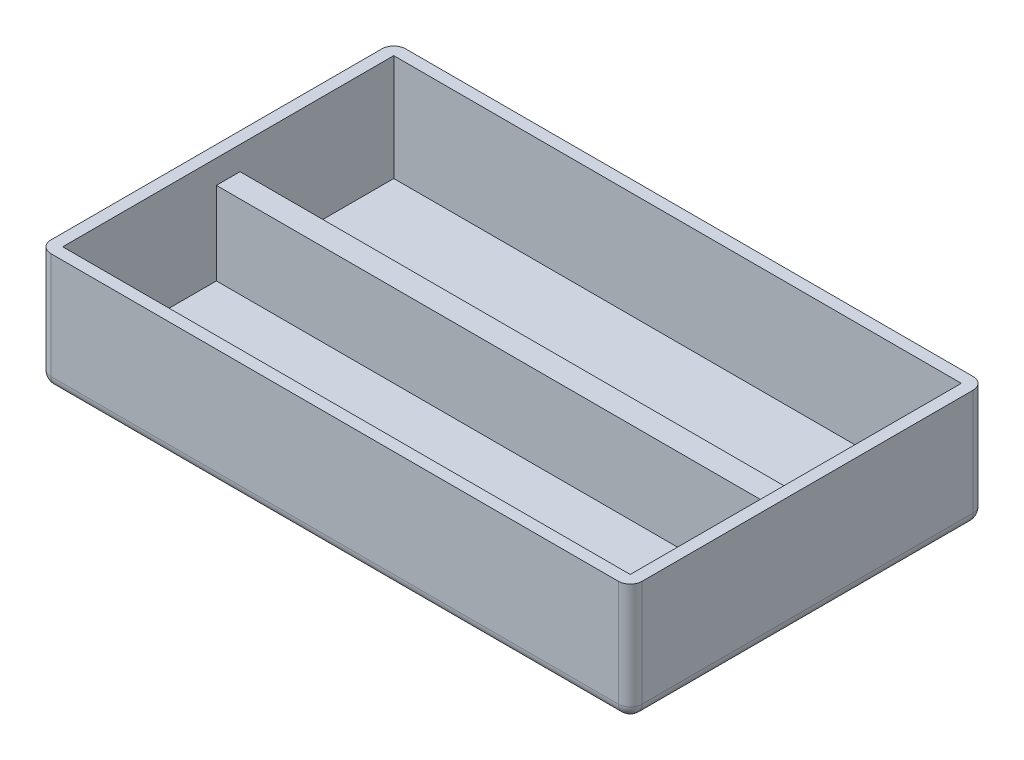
SolidWorks part; units mm, degrees
ref_plane "Front" through (0, 0, 0) normal (0, 0, 1) x (1, 0, 0)
ref_plane "Top" through (0, 0, 0) normal (0, 1, 0) x (1, 0, 0)
ref_plane "Right" through (0, 0, 0) normal (1, 0, 0) x (0, 0, -1)
sketch "Sketch1"
  dimension "D1" = 127
  dimension "D2" = 76.2
extrude "Extrude1" add sketch "Sketch1" along normal blind 25.4
fillet "Fillet1" radius 2.54 8 edges at (0, 0, 38.1) (63.5, 0, 0) (0, 0, -38.1) (-63.5, 0, 0) (-63.5, 12.7, -38.1) (63.5, 12.7, -38.1) (63.5, 12.7, 38.1) (-63.5, 12.7, 38.1)
shell "Shell1" thickness 2.54
ref_plane "Plane1" through (0, 20.32, 0) normal (0, 1, 0) x (-1, 0, 0)
sketch "Sketch2"
rib "Rib1" sketch "Sketch2" sketch "Sketch2" thickness 5.08 extrusion direction normal to sketch draft on no parameters "D1"=5.08
